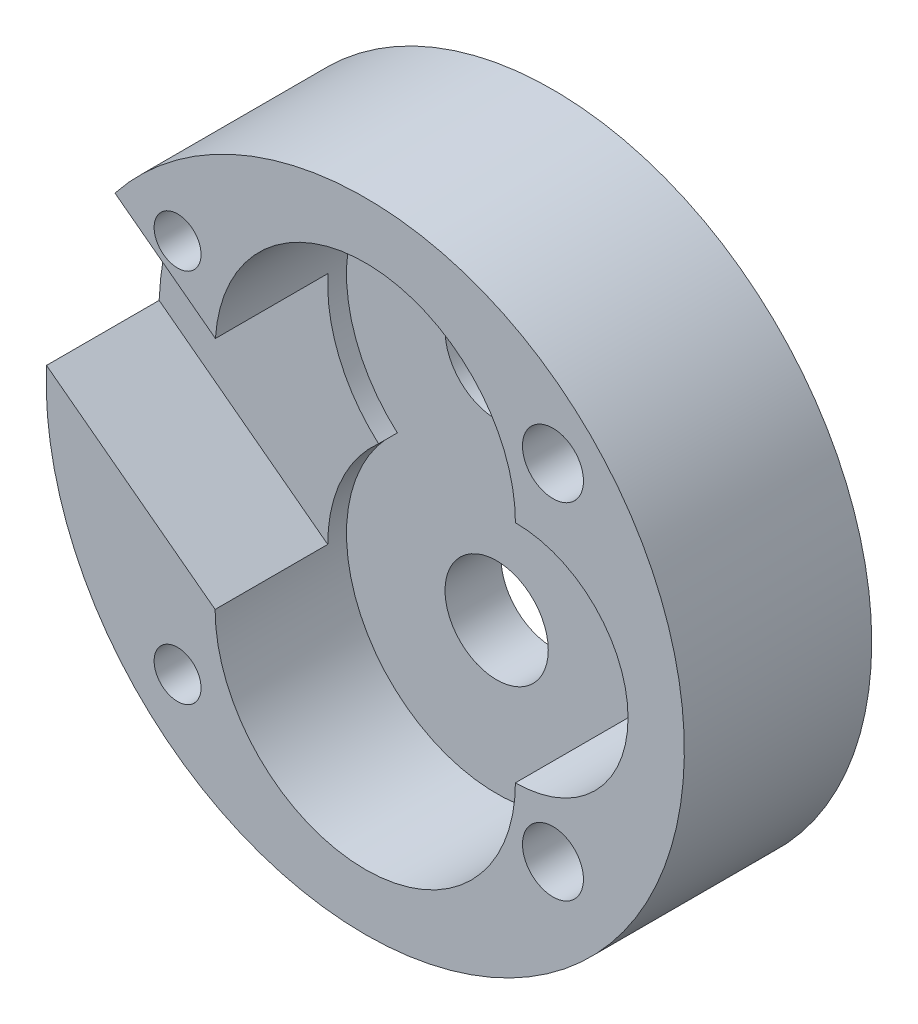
SolidWorks part; units mm, degrees
ref_plane "Front" through (0, 0, 0) normal (0, 0, 1) x (1, 0, 0)
ref_plane "Top" through (0, 0, 0) normal (0, 1, 0) x (1, 0, 0)
ref_plane "Right" through (0, 0, 0) normal (1, 0, 0) x (0, 0, -1)
sketch "Sketch1" plane through (0, 0, 0) normal (0, 0, 1) x (1, 0, 0)
  circle A0 centre (0, 0) radius 53.975
  dimension "D1" = 107.95
extrude "Base-Extrude" add sketch "Sketch1" along normal blind 31.6992
sketch "Sketch3" plane through (0, 0, 31.6992) normal (0, 0, 1) x (1, 0, 0)
  line L0 (0, 0) -> (25.4, 0) construction
  circle A0 centre (25.4, 0) radius 19.05
  dimension "D1" = 38.1
  dimension "D2" = 25.4
sketch "Sketch2" plane through (0, 0, 31.6992) normal (0, 0, 1) x (1, 0, 0)
  line L0 (0, 0) -> (34.0705, 0) construction
  line L1 (0, 19.05) -> (0, 0) construction
  arc A0 (-16.8005, 0) -> (16.8005, 0) centre (0, 19.05) cw
  arc A1 (-16.8005, 0) -> (16.8005, 0) centre (0, -19.05) ccw
  circle A2 centre (25.4, 0) radius 19.05 construction
  point P9 (25.4, 19.05)
  point P10 (-77.1757, 1.9593)
  dimension "D1" = 50.8
extrude "Cut-Extrude1" cut sketch "Sketch2" against normal blind 22.225
extrude "Cut-Extrude3" cut sketch "Sketch3" against normal blind 19.05
sketch "Sketch4" plane through (0, 0, 31.6992) normal (0, 0, 1) x (1, 0, 0)
  line L0 (-42.3426, 33.4725) -> (-25.3485, 20.6665)
  line L1 (-53.9198, 2.4412) -> (-25.4, -19.05)
  line L2 (0, -19.05) -> (-46.556, -19.05) construction
  circle A0 centre (0, 0) radius 53.975 construction
  arc A1 (25.4, 19.05) -> (-16.8005, 0) centre (0, 19.05) ccw construction
  arc A2 (-16.8005, 0) -> (25.4, -19.05) centre (0, -19.05) ccw construction
  arc A3 (-42.3426, 33.4725) -> (-53.9198, 2.4412) centre (0, 0) ccw
  arc A4 (-25.3485, 20.6665) -> (-16.8005, 0) centre (0, 19.05) ccw
  arc A5 (-16.8005, 0) -> (-25.4, -19.05) centre (0, -19.05) ccw
  dimension "D1" = 31.75
  dimension "D2" = 37
extrude "Cut-Extrude4" cut sketch "Sketch4" against normal up to surface (19.05 mm away)
sketch "Sketch5" plane through (0, 0, 9.4742) normal (0, 0, 1) x (1, 0, 0)
  circle A0 centre (0, -19.05) radius 8.7312
  circle A1 centre (0, 19.05) radius 8.7312
  dimension "D1" = 17.4625
extrude "Cut-Extrude5" cut sketch "Sketch5" against normal blind 22.225
sketch "Sketch6" plane through (0, 0, 31.6992) normal (0, 0, 1) x (1, 0, 0)
  circle A0 centre (31.75, 30.9138) radius 5.1594
  circle A1 centre (31.75, -27.4306) radius 5.1594
  dimension "D2" = 58.3444
  dimension "D4" = 10.3187
  dimension "D1" = 27.4306
  dimension "D3" = 31.75
extrude "Cut-Extrude6" cut sketch "Sketch6" against normal through all
sketch "Sketch7" plane through (0, 0, 31.6992) normal (0, 0, 1) x (1, 0, 0)
  circle A0 centre (-31.75, 31.75) radius 3.9688
  circle A1 centre (-31.75, -31.75) radius 3.9688
  circle A2 centre (31.75, -27.4306) radius 5.1594 construction
  dimension "D1" = 63.5
  dimension "D2" = 31.75
  dimension "D3" = 63.5
  dimension "D4" = 7.9375
extrude "Cut-Extrude7" cut sketch "Sketch7" against normal through all
